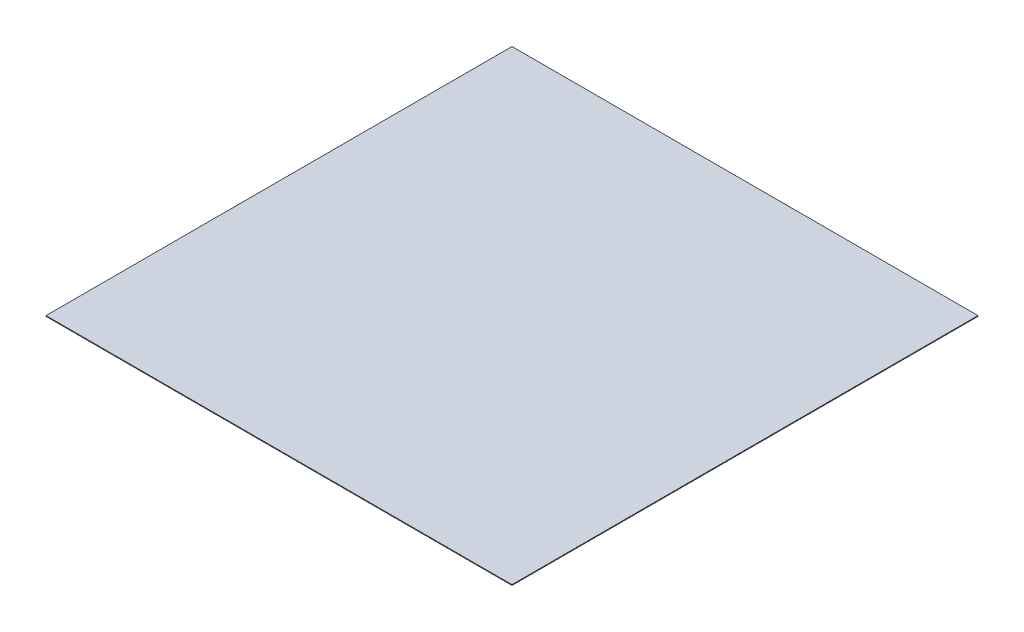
SolidWorks part; units mm, degrees
ref_plane "Front Plane" through (0, 0, 0) normal (0, 0, 1) x (1, 0, 0)
ref_plane "Top Plane" through (0, 0, 0) normal (0, 1, 0) x (1, 0, 0)
ref_plane "Right Plane" through (0, 0, 0) normal (1, 0, 0) x (0, 0, -1)
sketch "Sketch1" plane through (0, 0, 0) normal (0, 1, 0) x (1, 0, 0)
  line L1 (-609.6, -609.6) -> (609.6, -609.6)
  line L2 (-609.6, -609.6) -> (-609.6, 609.6)
  line L3 (-609.6, 609.6) -> (609.6, 609.6)
  line L4 (609.6, -609.6) -> (609.6, 609.6)
extrude "Extrude1" add sketch "Sketch1" along normal blind 1.905
